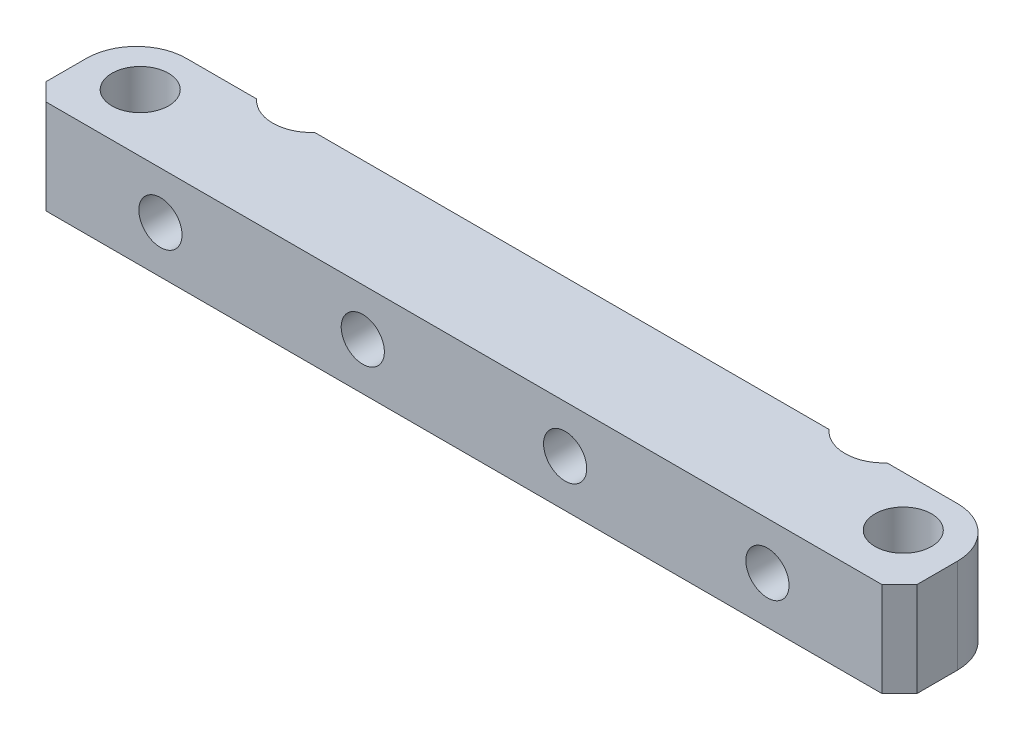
SolidWorks part; units mm, degrees
ref_plane "前视基准面" through (0, 0, 0) normal (0, 0, 1) x (1, 0, 0)
ref_plane "上视基准面" through (0, 0, 0) normal (0, 1, 0) x (1, 0, 0)
ref_plane "右视基准面" through (0, 0, 0) normal (1, 0, 0) x (0, 0, -1)
other "Configuration Table"
sketch "草图1" plane through (0, 0, 0) normal (0, 1, 0) x (1, 0, 0)
  line L0 (0, 0) -> (-28.2843, 28.2843) construction
  line L1 (0, 0) -> (0, 109.4307) construction
  line L2 (0, 0) -> (28.2843, 28.2843) construction
  line L4 (-32.2843, 32) -> (32.2843, 32)
  line L5 (-32.2843, 32) -> (-32.2843, 24)
  line L6 (-32.2843, 24) -> (32.2843, 24)
  line L7 (32.2843, 32) -> (32.2843, 24)
  circle A0 centre (-28.2843, 28.2843) radius 2.1
  circle A1 centre (28.2843, 28.2843) radius 2.1
  dimension "D3" = 4.2
  dimension "D4" = 4.2
  dimension "D1" = 45
  dimension "D2" = 40
  dimension "D5" = 40
  dimension "D6" = 24
  dimension "D7" = 8
  dimension "D8" = 4
  dimension "D9" = 4
extrude "凸台-拉伸1" add sketch "草图1" along normal blind 7
fillet "圆角1" radius 3.7 2 edges at (-32.2843, 3.5, -32) (32.2843, 3.5, -32)
sketch "草图2" plane through (0, 0, -24) normal (0, 0, 1) x (1, 0, 0)
  line L0 (-22.5, 3.5) -> (-7.5, 3.5) construction
  line L1 (-32.2843, 0) -> (32.2843, 0) construction
  circle A0 centre (-22.5, 3.5) radius 1.6
  circle A1 centre (-7.5, 3.5) radius 1.6
  circle A2 centre (7.5, 3.5) radius 1.6
  circle A3 centre (22.5, 3.5) radius 1.6
  dimension "D5" = 3.2
  dimension "D2" = 15
  dimension "D3" = 3.5
  dimension "D4" = 7.5
  dimension "D1" = 4
extrude "切除-拉伸1" cut sketch "草图2" against normal through all
chamfer "倒角1" distance 1.3 2 edges at (-32.2843, 3.5, -24) (32.2843, 3.5, -24)
sketch "草图4" plane through (0, 0, -32) normal (0, 0, -1) x (-1, 0, 0)
  circle A0 centre (-22.5, 3.5) radius 2.9
  circle A1 centre (22.5, 3.5) radius 2.9
  dimension "D1" = 5.8
  dimension "D2" = 5.8
extrude "切除-拉伸2" cut sketch "草图4" against normal blind 3.5
sketch "草图5" plane through (0, 0, 0) normal (0, -1, 0) x (1, 0, 0)
  circle A0 centre (21.2132, -33.9411) radius 2.9
  circle A1 centre (-21.2132, -33.9411) radius 2.9
  dimension "D1" = 5.8
  dimension "D2" = 5.8
extrude "切除-拉伸3" cut sketch "草图5" against normal through all
